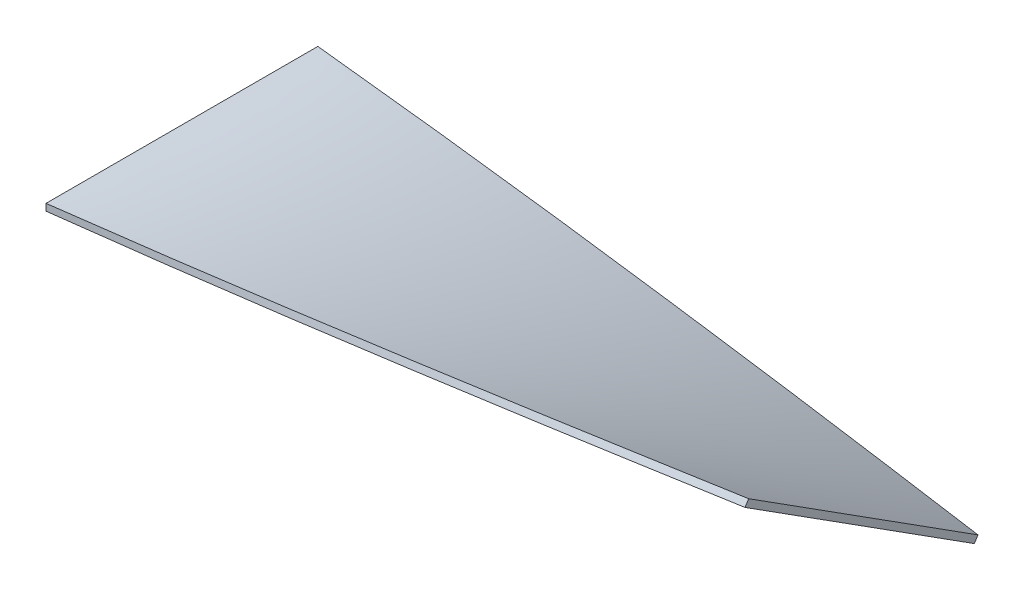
SolidWorks part; units mm, degrees
ref_plane "Vorne" through (0, 0, 0) normal (0, 0, 1) x (1, 0, 0)
ref_plane "Oben" through (0, 0, 0) normal (0, 1, 0) x (1, 0, 0)
ref_plane "Rechts" through (0, 0, 0) normal (1, 0, 0) x (0, 0, -1)
sketch "Skizze1" plane through (0, 0, 0) normal (0, 0, 1) x (1, 0, 0)
  line L0 (0, 0) -> (50, 0)
  dimension "D1" = 50
sketch "Skizze2" plane through (0, 0, 0) normal (1, 0, 0) x (0, 0, -1)
  line L1 (-10, -0.25) -> (10, -0.25)
  line L2 (-10, -0.25) -> (-10, 0.25)
  line L3 (-10, 0.25) -> (10, 0.25)
  line L4 (10, -0.25) -> (10, 0.25)
  line L5 (-10, -0.25) -> (10, 0.25) construction
  line L6 (-10, 0.25) -> (10, -0.25) construction
  point P0 (0, 0)
  dimension "D1" = 0.5
  dimension "D2" = 20
sweep "Austragung1" add profiles "Skizze2" path "Skizze1" parameters "D1"=32.48
